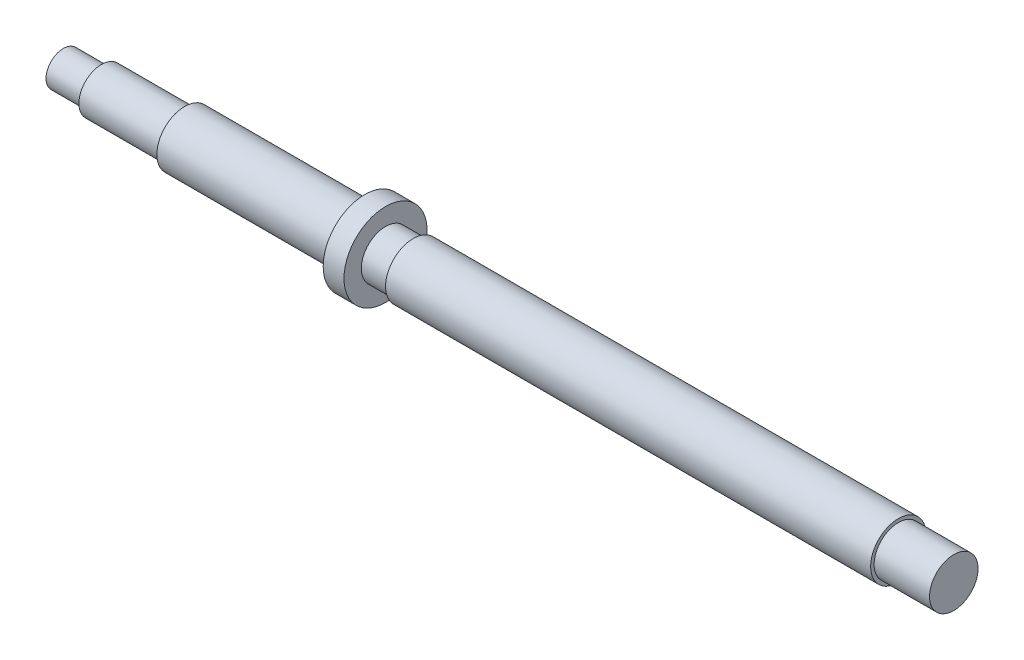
SolidWorks part; units mm, degrees
ref_plane "Front" through (0, 0, 0) normal (0, 0, 1) x (1, 0, 0)
ref_plane "Top" through (0, 0, 0) normal (0, 1, 0) x (1, 0, 0)
ref_plane "Right" through (0, 0, 0) normal (1, 0, 0) x (0, 0, -1)
sketch "Sketch1" plane through (0, 0, 0) normal (0, 0, 1) x (1, 0, 0)
  line L0 (0, 0) -> (271.2948, 0) construction
  line L1 (0, 0) -> (0, 5)
  line L2 (0, 5) -> (11, 5)
  line L3 (11, 5) -> (11, 6.5)
  line L4 (11, 6.5) -> (35, 6.5)
  line L5 (35, 6.5) -> (35, 8)
  line L6 (35, 8) -> (87, 8)
  line L7 (87, 8) -> (87, 12)
  line L8 (87, 12) -> (93, 12)
  line L9 (93, 12) -> (93, 7)
  line L10 (93, 7) -> (101, 7)
  line L11 (101, 7) -> (101, 8)
  line L12 (101, 8) -> (241, 8)
  line L13 (241, 8) -> (241, 7)
  line L14 (241, 7) -> (257, 7)
  line L15 (257, 7) -> (257, 0)
  line L16 (0, 0) -> (257, 0)
  dimension "D1" = 14
  dimension "D2" = 16
  dimension "D3" = 24
  dimension "D4" = 11
  dimension "D5" = 24
  dimension "D6" = 52
  dimension "D7" = 6
  dimension "D8" = 140
  dimension "D9" = 16
  dimension "D10" = 10
  dimension "D11" = 13
  dimension "D12" = 16
  dimension "D13" = 8
revolve "Revolve1" add sketch "Sketch1" angle 360 about L0
